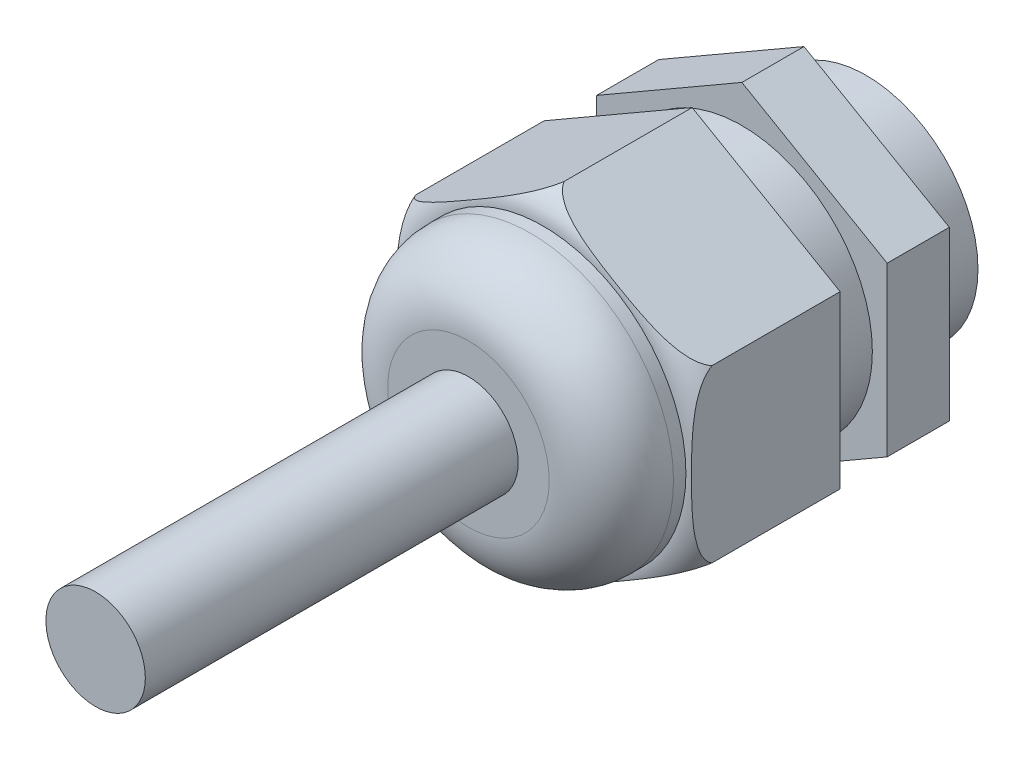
SolidWorks part; units mm, degrees
ref_plane "Plan de face" through (0, 0, 0) normal (0, 0, 1) x (1, 0, 0)
ref_plane "Plan de dessus" through (0, 0, 0) normal (0, 1, 0) x (1, 0, 0)
ref_plane "Plan de droite" through (0, 0, 0) normal (1, 0, 0) x (0, 0, -1)
imported_body "Importée1"
sketch "Esquisse1" plane through (0, 0, 32) normal (0, 0, 1) x (1, 0, 0)
  circle A0 centre (0, 0) radius 4
  dimension "D1" = 8
extrude "Extrusion1" add sketch "Esquisse1" along normal blind 30
